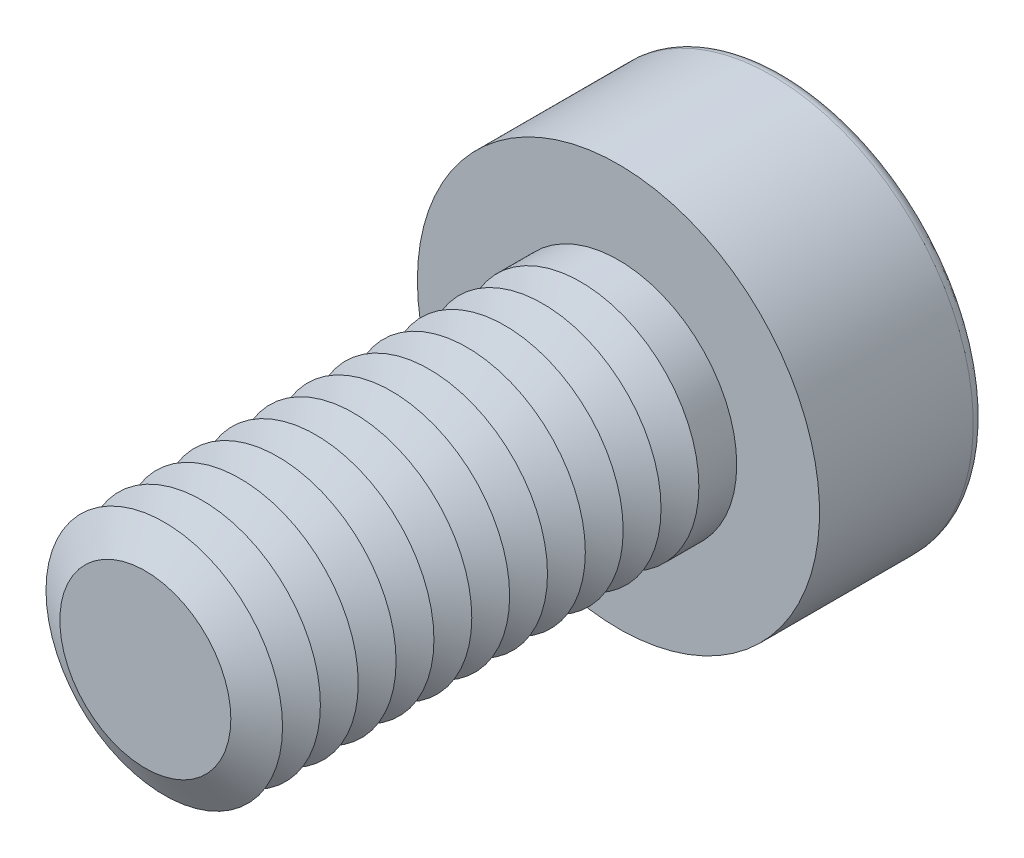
SolidWorks part; units mm, degrees
ref_plane "Front Plane" through (0, 0, 0) normal (0, 0, 1) x (1, 0, 0)
ref_plane "Top Plane" through (0, 0, 0) normal (0, 1, 0) x (1, 0, 0)
ref_plane "Right Plane" through (0, 0, 0) normal (1, 0, 0) x (0, 0, -1)
sketch "Sketch1" plane through (0, 0, 0) normal (0, 0, 1) x (1, 0, 0)
  circle A0 centre (0, 0) radius 2.5
  dimension "D1" = 5
extrude "Boss-Extrude1" add sketch "Sketch1" along normal blind 10
sketch "Sketch2" plane through (0, 0, 0) normal (0, 0, -1) x (-1, 0, 0)
  circle A0 centre (0, 0) radius 4.25
  dimension "D1" = 8.5
extrude "Boss-Extrude2" add sketch "Sketch2" along normal blind 3.5
sketch "Sketch3" plane through (0, 0, -3.5) normal (0, 0, -1) x (-1, 0, 0)
  line L1 (-0.866, 1.5) -> (-1.7321, 0)
  line L2 (-1.7321, 0) -> (-0.866, -1.5)
  line L3 (-0.866, -1.5) -> (0.866, -1.5)
  line L4 (0.866, -1.5) -> (1.7321, 0)
  line L5 (1.7321, 0) -> (0.866, 1.5)
  line L6 (0.866, 1.5) -> (-0.866, 1.5)
  circle A0 centre (0, 0) radius 1.5 construction
  dimension "D1" = 3
extrude "Cut-Extrude1" cut sketch "Sketch3" against normal blind 2.25
fillet "Fillet1" radius 0.25 1 edges at (-4.25, 0, -3.5)
sketch "Sketch4" plane through (0, 0, -1.25) normal (0, 0, -1) x (-1, 0, 0)
  line L0 (0.866, -1.5) -> (1.7321, 0) construction
  circle A0 centre (0, 0) radius 1.5
extrude "Cut-Extrude2" cut sketch "Sketch4" against normal through all draft 60
sketch "Sketch5" plane through (0, 0, -3.5) normal (0, 0, -1) x (-1, 0, 0)
  circle A0 centre (0, 0) radius 1.7321
extrude "Cut-Extrude3" cut sketch "Sketch5" against normal through all draft 75
sketch "Sketch7" plane through (0, 0, 0) normal (1, 0, 0) x (0, 0, -1)
  line L25 (-10, 1.8072) -> (-9.6, 2.5)
  line L26 (-10, 2.5) -> (-10, -2.5) construction
  line L27 (-9.6, 2.5) -> (-10.4, 2.5)
  line L28 (-10.4, 2.5) -> (-10, 1.8072)
  line L29 (0, 2.5) -> (-10, 2.5) construction
  dimension "D1" = 0.8
revolve "Cut-Revolve1" cut sketch "Sketch7" angle 360 about axis through (0, 0, 10) along (0, 0, -1)
pattern_linear "LPattern1" count 12 spacing 0.8 along (0, 0, -1) of "Cut-Revolve1"
